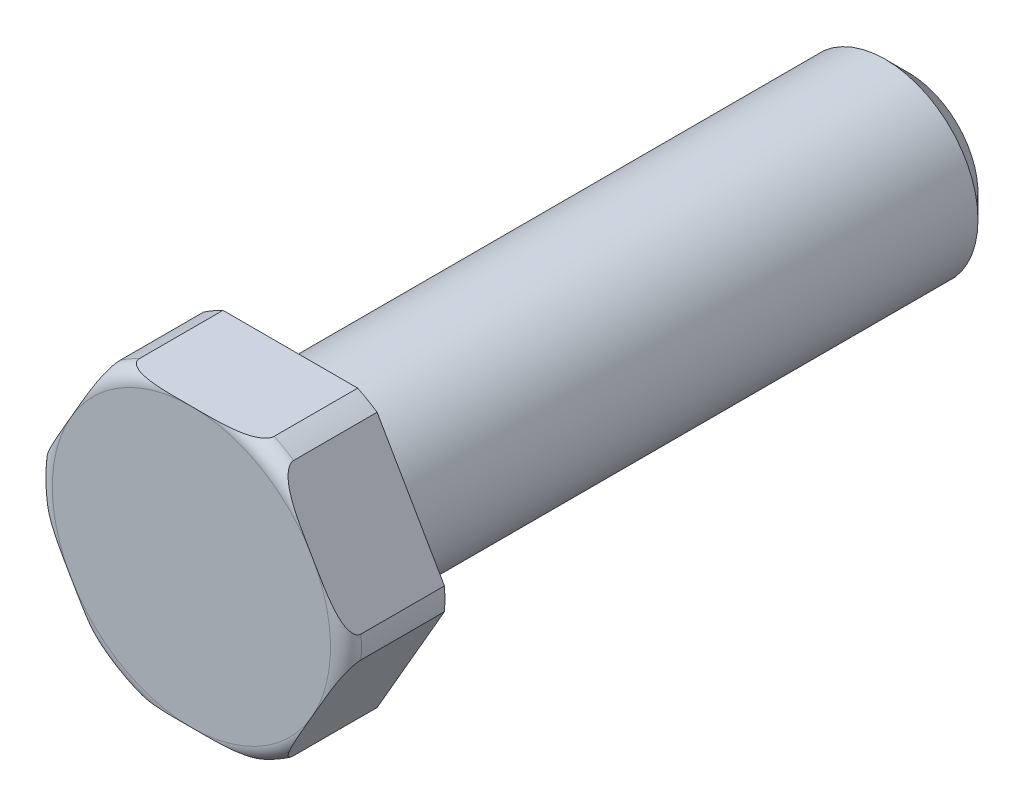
SolidWorks part; units mm, degrees
ref_plane "Plan1" through (0, 0, 0) normal (0, 0, 1) x (1, 0, 0)
ref_plane "Plan2" through (0, 0, 0) normal (0, 1, 0) x (1, 0, 0)
ref_plane "Plan3" through (0, 0, 0) normal (1, 0, 0) x (0, 0, -1)
sketch "Esquisse1" plane through (0, 0, 0) normal (0, 0, 1) x (1, 0, 0)
  circle A0 centre (0, 0) radius 10
  dimension "D1" = 20
extrude "Extrusion1" add sketch "Esquisse1" along normal blind 6.4
fillet "Congé1" radius 1
sketch "Esquisse2" plane through (0, 0, 6.4) normal (0, 0, 1) x (1, 0, 0)
  line L1 (10.3923, 0) -> (5.1962, 9)
  line L2 (5.1962, 9) -> (-5.1962, 9)
  line L3 (-5.1962, 9) -> (-10.3923, 0)
  line L4 (-10.3923, 0) -> (-5.1962, -9)
  line L5 (-5.1962, -9) -> (5.1962, -9)
  line L6 (5.1962, -9) -> (10.3923, 0)
  circle A0 centre (0, 0) radius 9 construction
  circle A1 centre (0, 0) radius 14.1421
  dimension "D1" = 18
extrude "Enlèv. mat.-Extru.1" cut sketch "Esquisse2" against normal through all
sketch "Esquisse3" plane through (0, 0, 0) normal (0, 0, -1) x (-1, 0, 0)
  circle A0 centre (0, 0) radius 6
  dimension "D1" = 12
extrude "Extrusion2" add sketch "Esquisse3" along normal blind 40
chamfer "Chanfrein1" distance 1.5 angle 45
